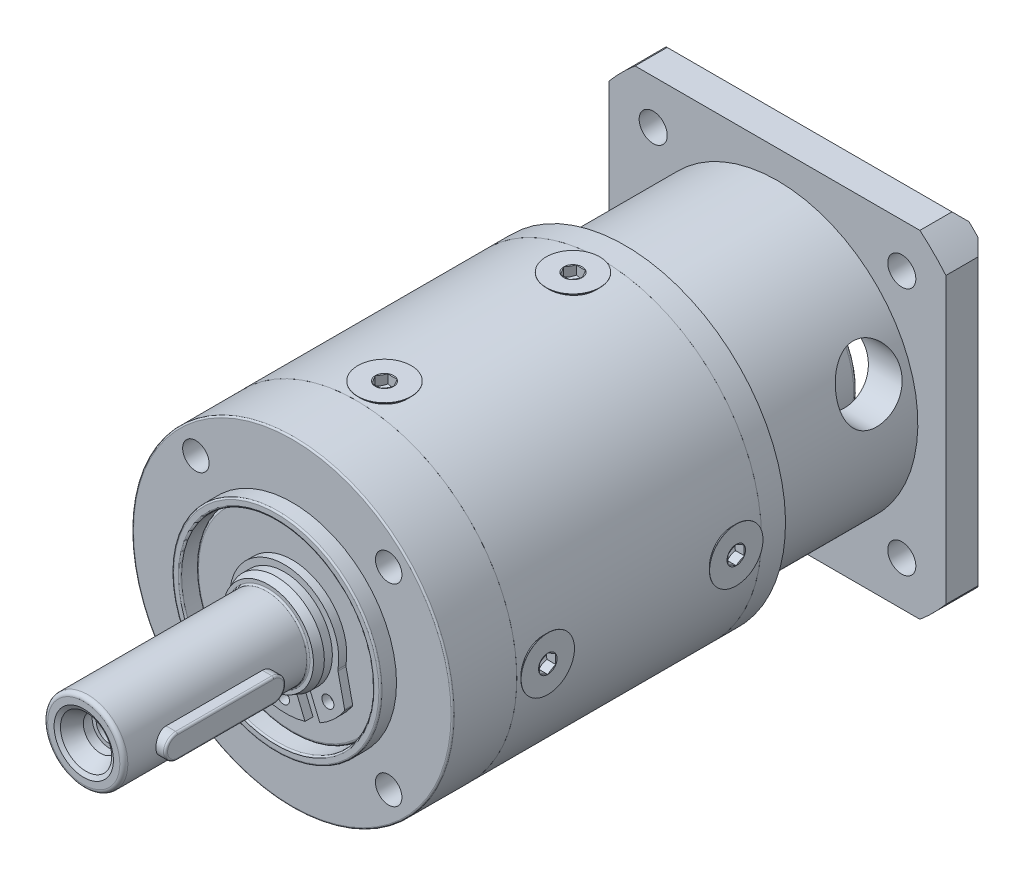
SolidWorks part; units mm, degrees
other "Éî¹µÇòÖá³Ð60000ÐÍ18ÏµÁÐ-1-solid2"
other "Éî¹µÇòÖá³Ð60000ÐÍ18ÏµÁÐ-1-solid5"
other "Éî¹µÇòÖá³Ð60000ÐÍ18ÏµÁÐ-1-solid1"
other "¿×ÓÃµ¯ÐÔµ²È¦AÐÍ-1-solid1"
other "³ÁÍ·ÂÝ¶¤M3¡Á6-4-solid1"
other "ÇÐ³ý-À Éì1[1]"
other "³ÁÍ·ÂÝ¶¤M3¡Á6-5-solid1"
other "ÇÐ³ý-À Éì1[2]"
other "³ÁÍ·ÂÝ¶¤M3¡Á6-8-solid1"
other "Éî¹µÇòÖá³Ð60000ÐÍ18ÏµÁÐ-1-solid3"
other "12.9-ÄÚÁù½ÇÔ²ÖùÍ·ÂÝ¶¤-M4-1-solid1"
other "³ÁÍ·ÂÝ¶¤M3¡Á6-2-solid1"
other "ÖáÓÃµ¯ÐÔµ²È¦AÐÍ£¨¡Ý10£©-1-solid1"
other "³ÁÍ·ÂÝ¶¤M3¡Á6-7-solid1"
other "PL40.090(ºÚÉ«)-1-solid1"
other "PL40.070.5-25-22-¿Ú31-%c3.5ºÚÉ«£¨61802Öá³Ð£©-1-solid1"
other "Éî¹µÇòÖá³Ð60000ÐÍ19ÏµÁÐ-1-solid1"
other "µ¯µæ-1-solid1"
other "ÆÕÍ¨Æ½¼üAÐÍ A3-1-solid1"
other "Éî¹µÇòÖá³Ð60000ÐÍ18ÏµÁÐ-1-solid4"
other "Éî¹µÇòÖá³Ð60000ÐÍ19ÏµÁÐ-2-solid1"
other "³ÁÍ·ÂÝ¶¤M3¡Á6-3-solid1"
other "¿×ÓÃµ¯ÐÔµ²È¦AÐÍ-2-solid1"
other "PL40.030.L1£¨ÉÁÒø£©-1-solid1"
other "³ÁÍ·ÂÝ¶¤M3¡Á6-6-solid1"
other "³ÁÍ·ÂÝ¶¤M3¡Á6-1-solid1"
other "PL40.040.08-05-1-solid1"
ref_plane "Front Plane" through (0, 0, 0) normal (0, 0, 1) x (1, 0, 0)
ref_plane "Top Plane" through (0, 0, 0) normal (0, 1, 0) x (1, 0, 0)
ref_plane "Right Plane" through (0, 0, 0) normal (1, 0, 0) x (0, 0, -1)
imported_body "Imported1"
imported_body "Imported2"
imported_body "Imported3"
imported_body "Imported4"
imported_body "Imported5"
imported_body "Imported6"
imported_body "Imported7"
imported_body "Imported8"
imported_body "Imported9"
imported_body "Imported10"
imported_body "Imported11"
imported_body "Imported12"
imported_body "Imported13"
imported_body "Imported14"
imported_body "Imported15"
imported_body "Imported16"
imported_body "Imported17"
imported_body "Imported18"
imported_body "Imported19"
imported_body "Imported20"
imported_body "Imported21"
imported_body "Imported22"
imported_body "Imported23"
imported_body "Imported24"
imported_body "Imported25"
imported_body "Imported26"
imported_body "Imported27"
sketch "Sketch1" plane through (0, 0, 46.25) normal (0, 0, 1) x (1, 0, 0)
  circle A0 centre (-4.8099, 13.8621) radius 7.75
  circle A1 centre (-4.8099, 13.8621) radius 10.3
  circle A2 centre (-4.8099, 13.8621) radius 10.3 construction
  circle A3 centre (-4.8099, 13.8621) radius 7.75 construction
extrude "Boss-Extrude1" add sketch "Sketch1" against normal blind 0.5
ref_plane "Plane1" through (-4.8099, 0, 0) normal (1, 0, 0) x (0, 0, -1)
ref_plane "Plane2" through (0, 13.8621, 0) normal (0, -1, 0) x (0, 0, -1)
move or copy body "Body-Move/Copy1" bodies to move or copy 106 119 copy no rotation origin (-4.8099, 13.8621, 0) rotation axis (0, 0, -1) rotation angle 77.377
ref_plane "Plane3" through (7.2109, 0, 0) normal (1, 0, 0) x (0, 0, -1)
ref_plane "Plane4" through (0, 0, 38.25) normal (0, 0, 1) x (1, 0, 0)
sketch "Sketch3" plane through (0, 0, 38.25) normal (0, 0, 1) x (1, 0, 0)
  circle A0 centre (7.2109, 25.883) radius 1.9
  circle A2 centre (7.2109, 25.883) radius 1.65 construction
  dimension "D1" = 0.25
extrude "Boss-Extrude4" add sketch "Sketch3" against normal blind 1.5
pattern_circular "CirPattern1" count 4 over 360 about axis through (-4.8099, 13.8621, 0) along (0, 0, 1) of "Boss-Extrude4"
